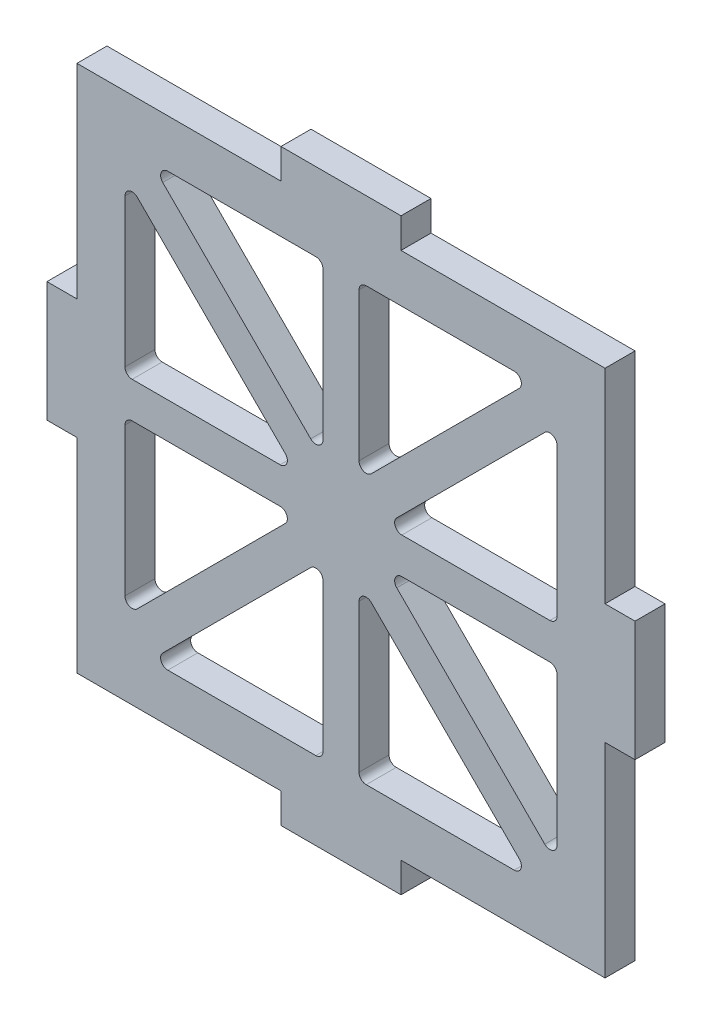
SolidWorks part; units mm, degrees
ref_plane "前视基准面" through (0, 0, 0) normal (0, 0, 1) x (1, 0, 0)
ref_plane "上视基准面" through (0, 0, 0) normal (0, 1, 0) x (1, 0, 0)
ref_plane "右视基准面" through (0, 0, 0) normal (1, 0, 0) x (0, 0, -1)
sketch "草图1" plane through (0, 0, 0) normal (0, 0, 1) x (1, 0, 0)
  line L1 (-22, 0) -> (22, 0)
  line L2 (-22, 0) -> (-22, 44)
  line L3 (-22, 44) -> (22, 44)
  line L4 (22, 0) -> (22, 44)
  dimension "D1" = 44
  dimension "D2" = 44
extrude "凸台-拉伸1" add sketch "草图1" along normal blind 2.5
sketch "草图2" plane through (0, 0, 2.5) normal (0, 0, 1) x (1, 0, 0)
  line L0 (-22, 22) -> (22, 22) construction
  line L1 (-22, 44) -> (-22, 0) construction
  line L2 (22, 0) -> (22, 44) construction
  line L3 (0, 44) -> (0, 0) construction
  line L4 (22, 44) -> (-22, 44) construction
  line L5 (5, 0) -> (5, -2.5)
  line L6 (-5, 44) -> (5, 44)
  line L7 (-5, 44) -> (-5, 46.5)
  line L8 (-5, 46.5) -> (5, 46.5)
  line L9 (5, 44) -> (5, 46.5)
  line L10 (22, 27) -> (24.5, 27)
  line L11 (22, 27) -> (22, 17)
  line L12 (22, 17) -> (24.5, 17)
  line L13 (24.5, 27) -> (24.5, 17)
  line L14 (-5, -2.5) -> (5, -2.5)
  line L15 (-5, 0) -> (-5, -2.5)
  line L16 (-5, 0) -> (5, 0)
  line L17 (-24.5, 27) -> (-24.5, 17)
  line L18 (-22, 17) -> (-24.5, 17)
  line L19 (-22, 27) -> (-22, 17)
  line L20 (-22, 27) -> (-24.5, 27)
  dimension "D1" = 2.5
  dimension "D2" = 10
  dimension "D3" = 2.5
  dimension "D4" = 10
extrude "凸台-拉伸2" add sketch "草图2" against normal up to surface (2.5 mm away)
sketch "草图3" plane through (0, 0, 2.5) normal (0, 0, 1) x (1, 0, 0)
  line L0 (0, 0) -> (0, 48.3471) construction
  line L1 (-24.5, 22) -> (24.5, 22) construction
  line L2 (-18, 40) -> (18, 40) construction
  line L3 (-18, 40) -> (-18, 4) construction
  line L4 (-18, 4) -> (18, 4) construction
  line L5 (18, 40) -> (18, 4) construction
  line L6 (-24.5, 27) -> (-24.5, 17) construction
  line L7 (24.5, 17) -> (24.5, 27) construction
  line L8 (22, 44) -> (5, 44) construction
  line L9 (22, 0) -> (22, 17) construction
  line L10 (-18, 40) -> (18, 4) construction
  line L11 (-18, 4) -> (18, 40) construction
  line L12 (-18, 36.4302) -> (-18, 24.1)
  line L13 (-17.4, 23.5) -> (-5.0698, 23.5)
  line L14 (-4.6456, 24.5243) -> (-16.9757, 36.8544)
  line L15 (-4.6456, 19.4757) -> (-16.9757, 7.1456)
  line L16 (-17.4, 20.5) -> (-5.0698, 20.5)
  line L17 (-18, 7.5698) -> (-18, 19.9)
  line L18 (18, 7.5698) -> (18, 19.9)
  line L19 (17.4, 20.5) -> (5.0698, 20.5)
  line L20 (4.6456, 19.4757) -> (16.9757, 7.1456)
  line L21 (4.6456, 24.5243) -> (16.9757, 36.8544)
  line L22 (17.4, 23.5) -> (5.0698, 23.5)
  line L23 (18, 36.4302) -> (18, 24.1)
  line L24 (-14.4302, 40) -> (-2.1, 40)
  line L25 (-1.5, 39.4) -> (-1.5, 27.0698)
  line L26 (-2.5243, 26.6456) -> (-14.8544, 38.9757)
  line L27 (2.5243, 26.6456) -> (14.8544, 38.9757)
  line L28 (1.5, 39.4) -> (1.5, 27.0698)
  line L29 (14.4302, 40) -> (2.1, 40)
  line L30 (14.4302, 4) -> (2.1, 4)
  line L31 (1.5, 4.6) -> (1.5, 16.9302)
  line L32 (2.5243, 17.3544) -> (14.8544, 5.0243)
  line L33 (-2.5243, 17.3544) -> (-14.8544, 5.0243)
  line L34 (-1.5, 4.6) -> (-1.5, 16.9302)
  line L35 (-14.4302, 4) -> (-2.1, 4)
  arc A0 (-18, 24.1) -> (-17.4, 23.5) centre (-17.4, 24.1) ccw
  arc A1 (-5.0698, 23.5) -> (-4.6456, 24.5243) centre (-5.0698, 24.1) ccw
  arc A2 (-18, 36.4302) -> (-16.9757, 36.8544) centre (-17.4, 36.4302) cw
  arc A3 (-18, 7.5698) -> (-16.9757, 7.1456) centre (-17.4, 7.5698) ccw
  arc A4 (-5.0698, 20.5) -> (-4.6456, 19.4757) centre (-5.0698, 19.9) cw
  arc A5 (-18, 19.9) -> (-17.4, 20.5) centre (-17.4, 19.9) cw
  arc A6 (18, 19.9) -> (17.4, 20.5) centre (17.4, 19.9) ccw
  arc A7 (5.0698, 20.5) -> (4.6456, 19.4757) centre (5.0698, 19.9) ccw
  arc A8 (18, 7.5698) -> (16.9757, 7.1456) centre (17.4, 7.5698) cw
  arc A9 (18, 36.4302) -> (16.9757, 36.8544) centre (17.4, 36.4302) ccw
  arc A10 (5.0698, 23.5) -> (4.6456, 24.5243) centre (5.0698, 24.1) cw
  arc A11 (18, 24.1) -> (17.4, 23.5) centre (17.4, 24.1) cw
  arc A12 (-14.8544, 38.9757) -> (-14.4302, 40) centre (-14.4302, 39.4) cw
  arc A13 (-1.5, 39.4) -> (-2.1, 40) centre (-2.1, 39.4) ccw
  arc A14 (-2.5243, 26.6456) -> (-1.5, 27.0698) centre (-2.1, 27.0698) ccw
  arc A15 (2.5243, 26.6456) -> (1.5, 27.0698) centre (2.1, 27.0698) cw
  arc A16 (1.5, 39.4) -> (2.1, 40) centre (2.1, 39.4) cw
  arc A17 (14.8544, 38.9757) -> (14.4302, 40) centre (14.4302, 39.4) ccw
  arc A18 (14.8544, 5.0243) -> (14.4302, 4) centre (14.4302, 4.6) cw
  arc A19 (1.5, 4.6) -> (2.1, 4) centre (2.1, 4.6) ccw
  arc A20 (2.5243, 17.3544) -> (1.5, 16.9302) centre (2.1, 16.9302) ccw
  arc A21 (-2.5243, 17.3544) -> (-1.5, 16.9302) centre (-2.1, 16.9302) cw
  arc A22 (-1.5, 4.6) -> (-2.1, 4) centre (-2.1, 4.6) cw
  arc A23 (-14.8544, 5.0243) -> (-14.4302, 4) centre (-14.4302, 4.6) ccw
  point P22 (-18, 23.5)
  point P27 (-18, 37.8787)
  point P37 (-18, 6.1213)
  point P38 (-18, 20.5)
  point P57 (18, 20.5)
  point P58 (18, 6.1213)
  point P59 (18, 37.8787)
  point P60 (18, 23.5)
  point P66 (-15.8787, 40)
  point P69 (-1.5, 40)
  point P81 (1.5, 40)
  point P82 (15.8787, 40)
  point P101 (1.5, 4)
  point P102 (-1.5, 4)
  dimension "D3" = 0.6
  dimension "D4" = 0.6
  dimension "D5" = 0.6
  dimension "D6" = 0.6
  dimension "D1" = 4
  dimension "D2" = 4
  dimension "D7" = 1.5
  dimension "D8" = 1.5
  dimension "D9" = 1.5
  dimension "D10" = 1.5
extrude "切除-拉伸1" cut sketch "草图3" against normal up to surface (2.5 mm away)
